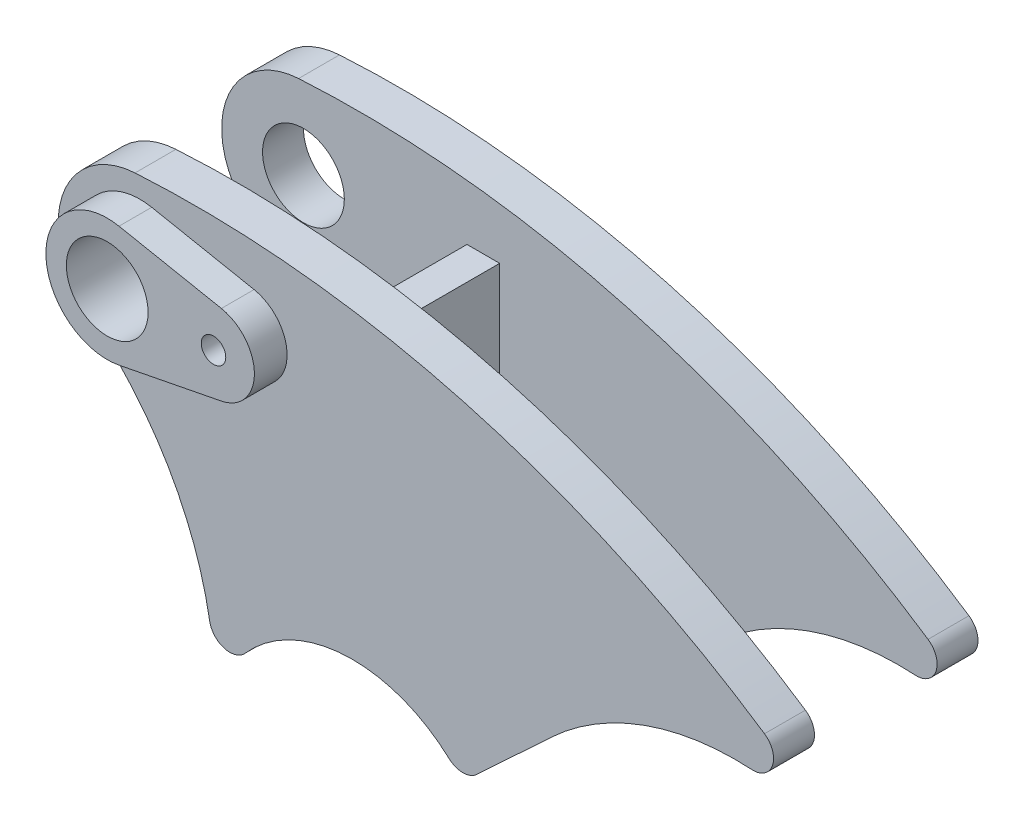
SolidWorks part; units mm, degrees
ref_plane "前视基准面" through (0, 0, 0) normal (0, 0, 1) x (1, 0, 0)
ref_plane "上视基准面" through (0, 0, 0) normal (0, 1, 0) x (1, 0, 0)
ref_plane "右视基准面" through (0, 0, 0) normal (1, 0, 0) x (0, 0, -1)
sketch "草图1" plane through (0, 0, 0) normal (0, 0, 1) x (1, 0, 0)
  line L0 (0, 0) -> (236.8259, 0) construction
  line L1 (82.41, -65.6568) -> (100.6938, -48.6068)
  arc A0 (-1.1912, 19.9645) -> (-12.5602, -15.5641) centre (0, 0) ccw
  arc A1 (-1.1912, 19.9645) -> (152.7817, -21.8513) centre (13.6991, -229.5917) cw
  arc A2 (149.6976, -30.997) -> (152.7817, -21.8513) centre (150, -26.0061) ccw
  arc A3 (17.0747, -65.8611) -> (25.7466, -68.311) centre (22, -65) ccw
  arc A4 (75.6216, -65.686) -> (82.41, -65.6568) centre (79, -62) ccw
  arc A5 (-12.5602, -15.5641) -> (17.0747, -65.8611) centre (-64.6852, -80.155) cw
  arc A6 (25.7466, -68.311) -> (75.6216, -65.686) centre (51.9731, -91.488) cw
  arc A7 (149.6976, -30.997) -> (100.6938, -48.6068) centre (145.7057, -96.8762) ccw
  dimension "D1" = 40
  dimension "D2" = 250
  dimension "D3" = 10
  dimension "D4" = 5
  dimension "D5" = 10
  dimension "D6" = 65
  dimension "D7" = 57
  dimension "D8" = 150
  dimension "D9" = 22
  dimension "D10" = 62
  dimension "D12" = 83
  dimension "D13" = 35
  dimension "D14" = 66
  dimension "D15" = 43
  dimension "D16" = 25
extrude "拉伸1" add sketch "草图1" along normal blind 10 from offset 15
sketch "草图2" plane through (0, 0, 0) normal (0, 0, 1) x (1, 0, 0)
  line L1 (82.41, -65.6568) -> (100.6938, -48.6068)
  line L2 (82.41, -65.6568) -> (100.6938, -48.6068)
  arc A8 (152.7817, -21.8513) -> (-1.1912, 19.9645) centre (13.6991, -229.5917) ccw
  arc A9 (149.6976, -30.997) -> (152.7817, -21.8513) centre (150, -26.0061) ccw
  arc A10 (149.6976, -30.997) -> (100.6938, -48.6068) centre (145.7057, -96.8762) ccw
  arc A11 (75.6216, -65.686) -> (82.41, -65.6568) centre (79, -62) ccw
  arc A12 (75.6216, -65.686) -> (25.7466, -68.311) centre (51.9731, -91.488) ccw
  arc A13 (17.0747, -65.8611) -> (25.7466, -68.311) centre (22, -65) ccw
  arc A14 (17.0747, -65.8611) -> (-12.5602, -15.5641) centre (-64.6852, -80.155) ccw
  arc A15 (-1.1912, 19.9645) -> (-12.5602, -15.5641) centre (0, 0) ccw
  arc A16 (152.7817, -21.8513) -> (-1.1912, 19.9645) centre (13.6991, -229.5917) ccw
  arc A17 (149.6976, -30.997) -> (152.7817, -21.8513) centre (150, -26.0061) ccw
  arc A18 (149.6976, -30.997) -> (100.6938, -48.6068) centre (145.7057, -96.8762) ccw
  arc A19 (75.6216, -65.686) -> (82.41, -65.6568) centre (79, -62) ccw
  arc A20 (75.6216, -65.686) -> (25.7466, -68.311) centre (51.9731, -91.488) ccw
  arc A21 (17.0747, -65.8611) -> (25.7466, -68.311) centre (22, -65) ccw
  arc A22 (17.0747, -65.8611) -> (-12.5602, -15.5641) centre (-64.6852, -80.155) ccw
  arc A23 (-1.1912, 19.9645) -> (-12.5602, -15.5641) centre (0, 0) ccw
  dimension "D1" = 0
extrude "拉伸2" add sketch "草图2" against normal blind 10 from offset 15
sketch "草图3" plane through (0, 0, 25) normal (0, 0, 1) x (1, 0, 0)
  line L1 (40, 5.4083) -> (48, 5.4083)
  line L2 (40, 5.4083) -> (40, -34.5917)
  line L3 (40, -34.5917) -> (48, -34.5917)
  line L4 (48, 5.4083) -> (48, -34.5917)
  arc A0 (152.7817, -21.8513) -> (-1.1912, 19.9645) centre (13.6991, -229.5917) ccw construction
  dimension "D1" = 8
  dimension "D2" = 40
  dimension "D3" = 40
  dimension "D4" = 15
extrude "拉伸3" add sketch "草图3" against normal up to surface (40 mm away)
sketch "草图4" plane through (0, 0, 25) normal (0, 0, 1) x (1, 0, 0)
  line L0 (0, 0) -> (26, 0) construction
  line L1 (2.8846, 14.72) -> (27.9231, 9.8133)
  line L2 (2.8846, -14.72) -> (27.9231, -9.8133)
  arc A0 (2.8846, 14.72) -> (2.8846, -14.72) centre (0, 0) ccw
  arc A1 (27.9231, -9.8133) -> (27.9231, 9.8133) centre (26, 0) ccw
  dimension "D1" = 30
  dimension "D2" = 20
  dimension "D3" = 26
extrude "拉伸4" add sketch "草图4" along normal blind 8
sketch "草图5" plane through (0, 0, 33) normal (0, 0, 1) x (1, 0, 0)
  circle A0 centre (0, 0) radius 10
  dimension "D1" = 20
extrude "切除-拉伸1" cut sketch "草图5" against normal through all
sketch "草图6" plane through (0, 0, 33) normal (0, 0, 1) x (1, 0, 0)
  circle A0 centre (26, 0) radius 3
  dimension "D1" = 6
extrude "切除-拉伸2" cut sketch "草图6" against normal blind 20
